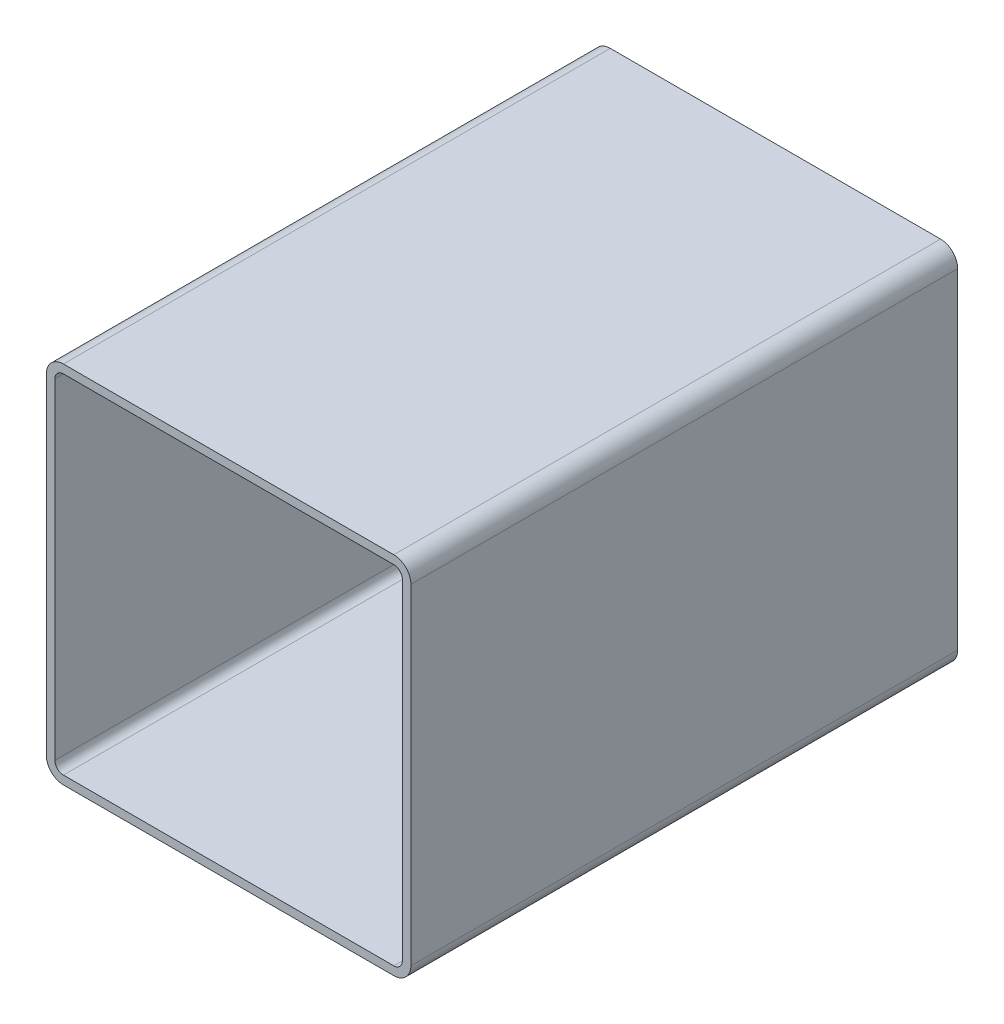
SolidWorks part; units mm, degrees
ref_plane "Front Plane" through (0, 0, 0) normal (0, 0, 1) x (1, 0, 0)
ref_plane "Top Plane" through (0, 0, 0) normal (0, 1, 0) x (1, 0, 0)
ref_plane "Right Plane" through (0, 0, 0) normal (1, 0, 0) x (0, 0, -1)
sketch "Sketch1" plane through (0, 0, 0) normal (0, 0, 1) x (1, 0, 0)
sketch_block_instance "HSS8x8x0.1875-1"
sketch_block "HSS8x8x0.1875"
extrude "Boss-Extrude1" add sketch "Sketch1" along normal blind 304.8
